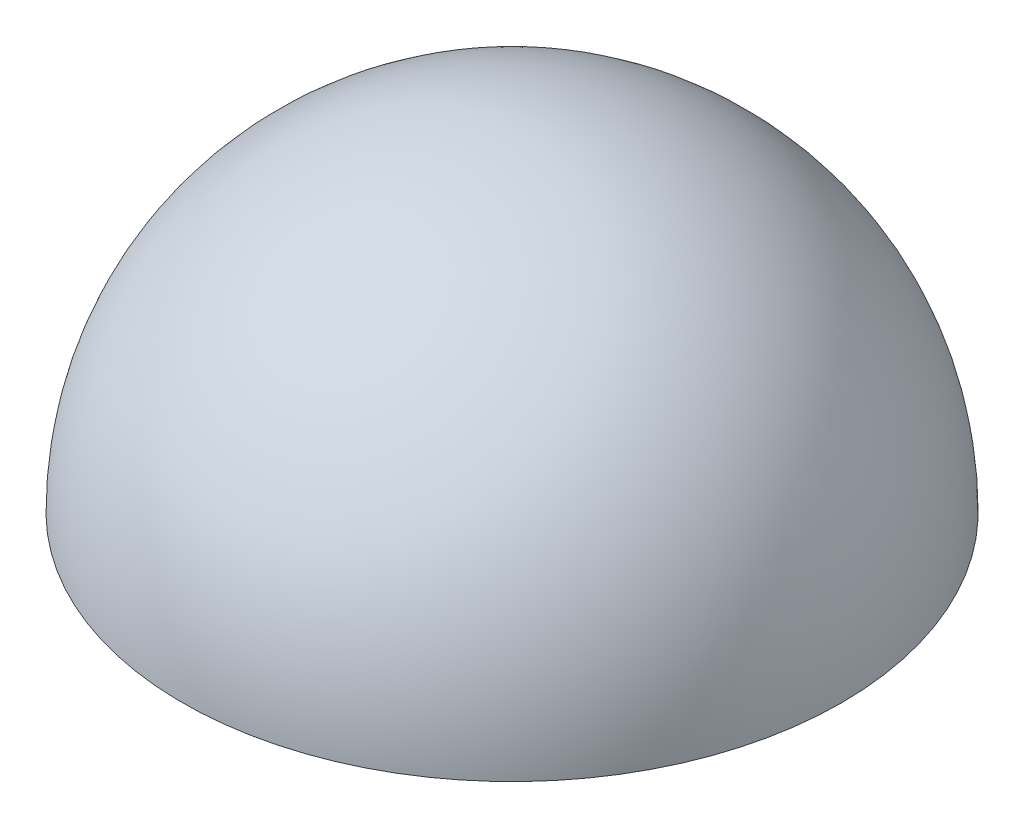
SolidWorks part; units mm, degrees
ref_plane "Front Plane" through (0, 0, 0) normal (0, 0, 1) x (1, 0, 0)
ref_plane "Top Plane" through (0, 0, 0) normal (0, 1, 0) x (1, 0, 0)
ref_plane "Right Plane" through (0, 0, 0) normal (1, 0, 0) x (0, 0, -1)
sketch "Sketch1" plane through (0, 0, 0) normal (0, 1, 0) x (1, 0, 0)
  arc A0 (-21.6651, 0) -> (21.8349, 0) centre (0.0849, 0) cw
sketch "Sketch2" plane through (0, 0, 0) normal (0, 1, 0) x (1, 0, 0)
  line L0 (-26.7882, 0) -> (25.8261, 0) construction
revolve "Revolve-Thin1" add sketch "Sketch1" angle 180 about L0
